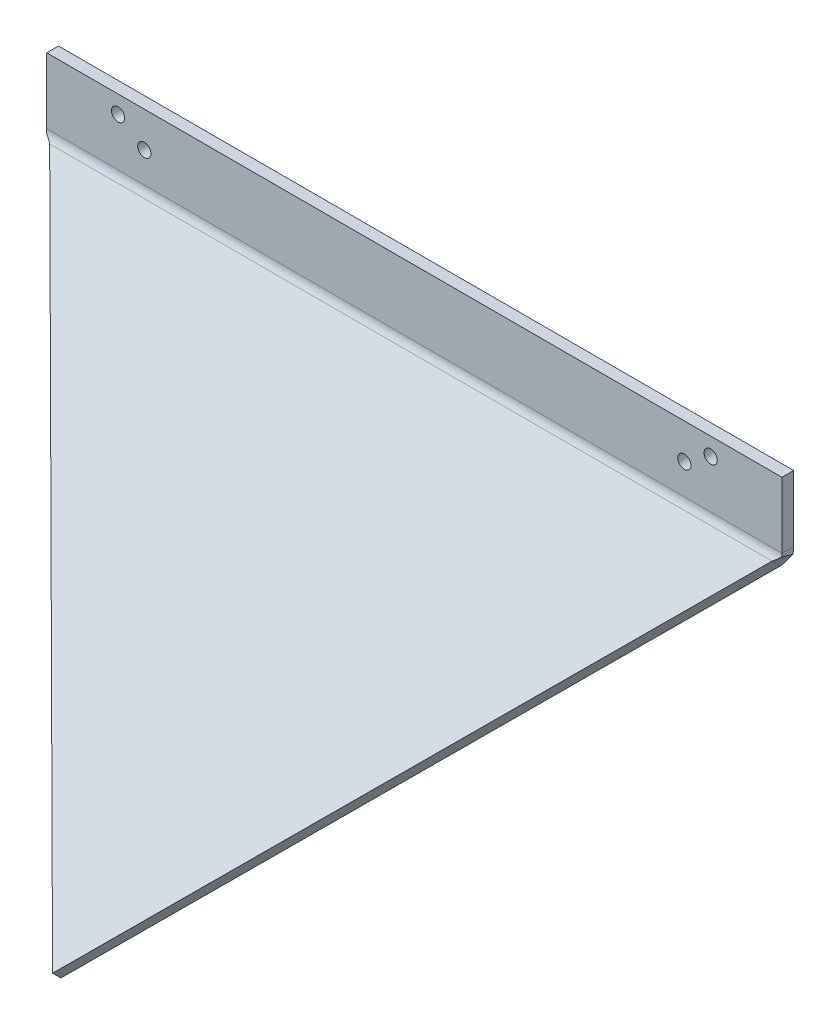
SolidWorks part; units mm, degrees
ref_plane "Front Plane" through (0, 0, 0) normal (0, 0, 1) x (1, 0, 0)
ref_plane "Top Plane" through (0, 0, 0) normal (0, 1, 0) x (1, 0, 0)
ref_plane "Right Plane" through (0, 0, 0) normal (1, 0, 0) x (0, 0, -1)
sketch "Sketch1" plane through (0, 0, 0) normal (0, 0, 1) x (1, 0, 0)
  line L0 (0, 0) -> (-396.875, 556.7756)
  line L1 (0, 0) -> (396.875, 556.7756)
  line L2 (396.875, 556.7756) -> (396.875, 632.9756)
  line L3 (396.875, 632.9756) -> (-396.875, 632.9756)
  line L4 (-396.875, 632.9756) -> (-396.875, 556.7756)
  line L5 (0, 0) -> (0, 632.9756) construction
  dimension "D1" = 793.75
  dimension "D2" = 76.2
  dimension "D3" = 556.7756
sheet metal parameters "Sheet-Metal2" thickness 12.7 parameters "D1"=0.7366
base flange "Base-Flange2" sketch "Sketch1" thickness 12.7 reverse thickness direction yes parameters "D1"=0.7366
sketch "Sketch6" plane through (0, 0, 12.7) normal (0, 0, 1) x (1, 0, 0)
  line L0 (-396.875, 556.7756) -> (396.875, 556.7756)
sketched bend "Sketched Bend1" parameters "D1"=12.7
bend "SketchBend1" bend radius 12.7 bend angle 45 parameters "D5"=1
hole_wizard "9/16 (0.5625) Diameter Hole1" positions "Sketch8" profile "Sketch7" hole size "9/16" standard "Ansi Inch"
sketch "Sketch8" plane through (0, 0, 0) normal (0, 0, -1) x (-1, 0, 0)
  point P0 (291.483, 594.8756)
  point P1 (319.8684, 613.9256)
sketch "Sketch7" plane through (-291.483, 594.8756, 0) normal (1, 0, 0) x (0, 1, 0)
  line L0 (0, 0) -> (0, 93.1924)
  line L1 (0, 93.1924) -> (7.1437, 88.9)
  line L2 (7.1437, 88.9) -> (7.1437, 0)
  line L5 (7.1437, 0) -> (0, 0)
  line L10 (0, 93.1924) -> (-7.1438, 88.9) construction
  line L11 (0, -6.35) -> (0, 107.95) construction
  dimension "Hole Dia." = 14.2875
  dimension "Hole Depth" = 88.9
  dimension "Drill Angle" = 118
mirror "Mirror1" about plane through (0, 0, 0) normal (1, 0, 0) of "9/16 (0.5625) Diameter Hole1"
flat pattern "Flat-Pattern2"
sketch "Bend-Lines2" plane through (0, 0, 0) normal (0, 1, 0) x (-1, 0, 0)
bend of the flat pattern "Flatten-<SketchBend1>1"
